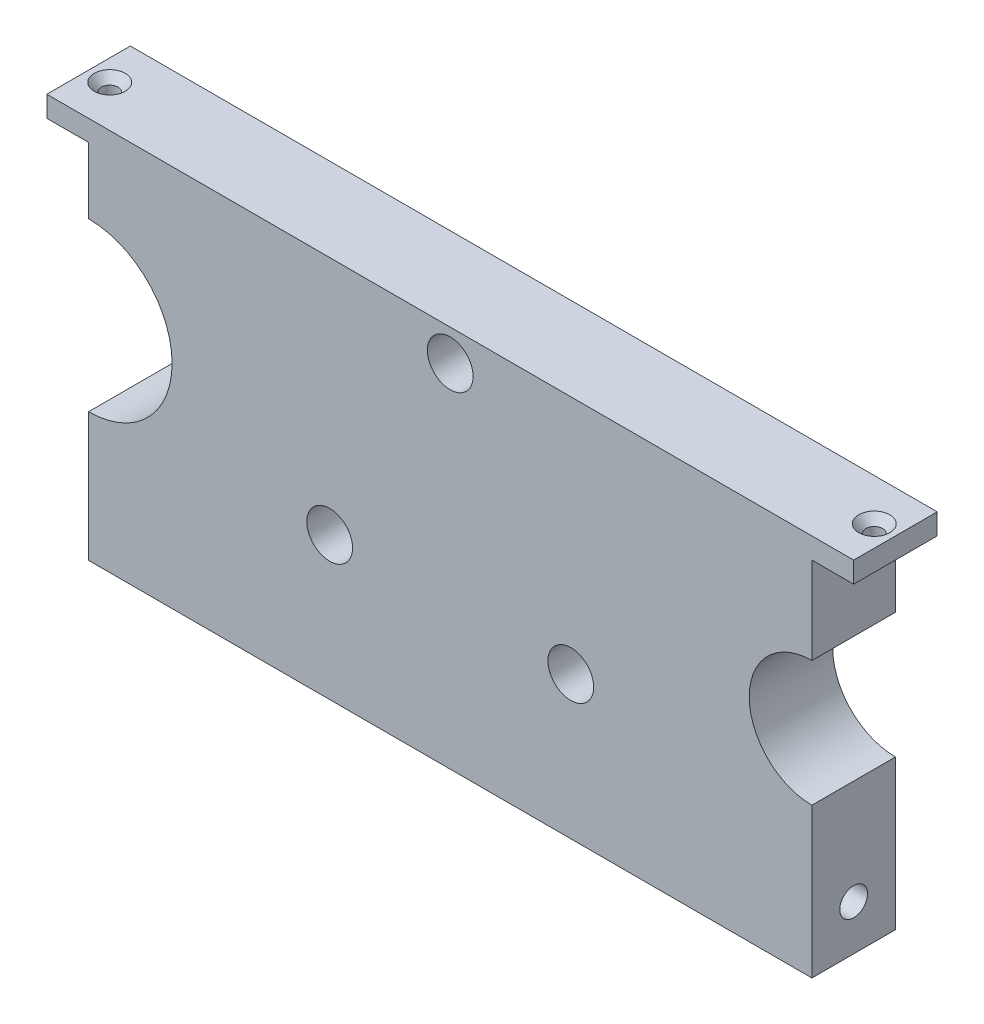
SolidWorks part; units mm, degrees
ref_plane "Front Plane" through (0, 0, 0) normal (0, 0, 1) x (1, 0, 0)
ref_plane "Top Plane" through (0, 0, 0) normal (0, 1, 0) x (1, 0, 0)
ref_plane "Right Plane" through (0, 0, 0) normal (1, 0, 0) x (0, 0, -1)
sketch "Sketch1" plane through (0, 0, 0) normal (1, 0, 0) x (0, 0, -1)
  line L1 (-9.525, -48.4187) -> (9.525, -48.4187)
  line L2 (-9.525, -48.4187) -> (-9.525, 34.1313)
  line L3 (-9.525, 34.1313) -> (9.525, 34.1313)
  line L4 (9.525, -48.4187) -> (9.525, 34.1313)
  line L5 (-9.525, -48.4187) -> (9.525, 34.1313) construction
  line L6 (-9.525, 34.1313) -> (9.525, -48.4187) construction
  dimension "D1" = 19.05
  dimension "D2" = 82.55
  dimension "D3" = 34.1313
extrude "Boss-Extrude1" add sketch "Sketch1" along normal mid plane 164.973
sketch "Sketch9" plane through (0, 0, 0) normal (0, 0, 1) x (1, 0, 0)
  line L0 (82.4865, 34.1313) -> (82.4865, -48.4187) construction
  line L1 (-82.4865, 34.1313) -> (-82.4865, -48.4187) construction
  circle A0 centre (82.4865, 0) radius 14.2875
  circle A1 centre (-82.4865, 0) radius 19.05
  dimension "D1" = 14.2875
  dimension "D2" = 19.05
extrude "Cut-Extrude1" cut sketch "Sketch9" against normal through all and the other way through all
sketch "Sketch8" plane through (0, 0, 0) normal (0, 0, 1) x (1, 0, 0)
  line L0 (-12.7, 38.8938) -> (12.7, 38.8938)
  line L1 (82.4865, 38.8938) -> (12.7, 38.8938)
  line L2 (82.4865, 34.1313) -> (-82.4865, 34.1313)
  line L3 (-82.4865, 38.8938) -> (-12.7, 38.8938)
  line L4 (-82.4865, 34.1313) -> (-92.0115, 34.1313)
  line L5 (-92.0115, 34.1313) -> (-92.0115, 38.8938)
  line L6 (0, 0) -> (0, -20.1707) construction
  line L7 (-92.0115, 38.8938) -> (-82.4865, 38.8938)
  line L8 (92.0115, 38.8938) -> (82.4865, 38.8938)
  line L9 (92.0115, 34.1313) -> (92.0115, 38.8938)
  line L10 (82.4865, 34.1313) -> (92.0115, 34.1313)
  point P2 (0, 38.8938)
  dimension "D1" = 4.7625
  dimension "D2" = 25.4
  dimension "D3" = 184.023
  dimension "D4" = 4.7625
  dimension "D5" = 164.973
extrude "Boss-Extrude2" add sketch "Sketch8" along normal mid plane 19.05
hole_wizard "1/4 (0.25) DiaHole #10 Insert" positions "Sketch3" profile "Sketch2" hole size "1/4" standard "ANSI Inch"
sketch "Sketch3" plane through (-82.4865, 0, 0) normal (-1, 0, 0) x (0, 0, 1)
  line L2 (9.525, 34.1313) -> (-9.525, 34.1313) construction
  point P1 (0, -38.1063)
  dimension "D1" = 72.2376
sketch "Sketch2" plane through (-82.4865, -38.1063, 0) normal (0, 1, 0) x (0, 0, 1)
  line L0 (0, 0) -> (0, 11.4327)
  line L1 (0, 11.4327) -> (3.175, 9.525)
  line L2 (3.175, 9.525) -> (3.175, 0)
  line L5 (3.175, 0) -> (0, 0)
  line L10 (0, 11.4327) -> (-3.175, 9.525) construction
  line L11 (0, -6.35) -> (0, 107.95) construction
  dimension "Hole Dia." = 6.35
  dimension "Hole Depth" = 9.525
  dimension "Drill Angle" = 118
mirror "Mirror1" about plane through (0, 0, 0) normal (1, 0, 0) of "1/4 (0.25) DiaHole #10 Insert"
hole_wizard "CSK for #10 Flat Head Socket Cap Screw3" positions "Sketch7" profile "Sketch6" countersink size "#10" standard "ANSI Inch"
sketch "Sketch7" plane through (0, 0, 9.525) normal (0, 0, 1) x (1, 0, 0)
  line L0 (0, 0) -> (27.4963, -15.875) construction
  line L1 (0, 0) -> (0, 31.75) construction
  line L2 (0, 0) -> (-27.4963, -15.875) construction
  circle A0 centre (0, 0) radius 31.75 construction
  point P0 (0, 31.75)
  point P6 (27.4963, -15.875)
  point P8 (-27.4963, -15.875)
  dimension "D1" = 63.5
  dimension "D2" = 120
  dimension "D3" = 120
sketch "Sketch6" plane through (0, 31.75, 9.525) normal (1, 0, 0) x (0, -1, 0)
  line L0 (0, 0) -> (0, 19.05)
  line L1 (0, 19.05) -> (2.5527, 19.05)
  line L2 (2.5527, 19.05) -> (2.5527, 15.768)
  line L3 (2.5527, 15.768) -> (5.2197, 12.7)
  line L4 (5.2197, 12.7) -> (5.2197, 0)
  line L6 (5.2197, 0) -> (0, 0)
  line L7 (-2.5527, 15.768) -> (-5.2197, 12.7) construction
  line L11 (0, -6.35) -> (0, 107.95) construction
  dimension "Thru Hole Dia." = 5.1054
  dimension "Thru Hole Depth" = 19.05
  dimension "C'Sink Dia." = 10.4394
  dimension "C'Sink Angle" = 82
  dimension "Head Clearance" = 12.7
hole_wizard "CSK for #6 Flat Head Machine Screw1" positions "Sketch13" profile "Sketch12" countersink size "#6" standard "ANSI Inch"
sketch "Sketch13" plane through (0, 38.8938, 0) normal (0, 1, 0) x (1, 0, 0)
  point P0 (-87.1855, 0)
  point P1 (87.1855, 0)
  dimension "D1" = 87.1855
  dimension "D2" = 87.1855
sketch "Sketch12" plane through (-87.1855, 38.8938, 0) normal (1, 0, 0) x (0, 0, 1)
  line L0 (0, 0) -> (0, 87.3125)
  line L1 (0, 87.3125) -> (1.8986, 87.3125)
  line L2 (1.8986, 87.3125) -> (1.8986, 1.892)
  line L3 (1.8986, 1.892) -> (3.5433, 0)
  line L5 (3.5433, 0) -> (0, 0)
  line L6 (-1.8986, 1.892) -> (-3.5433, 0) construction
  line L11 (0, -6.35) -> (0, 107.95) construction
  dimension "Thru Hole Dia." = 3.7973
  dimension "Thru Hole Depth" = 87.3125
  dimension "Near C'Sink Dia." = 7.0866
  dimension "Near C'Sink Angle" = 82
sketch "Sketch10" plane through (0, 0, 0) normal (0, 0, 1) x (1, 0, 0)
  line L0 (-22.225, 44.45) -> (-22.225, 69.9129)
  line L5 (22.225, 44.45) -> (22.225, 69.9129)
  line L6 (-22.225, 69.9129) -> (22.225, 69.9129)
  arc A0 (-22.225, 44.45) -> (22.225, 44.45) centre (0, 44.45) ccw
  dimension "D1" = 44.45
  dimension "D2" = 44.45
extrude "Cut-Extrude2" [suppressed] cut sketch "Sketch10" against normal through all and the other way through all
chamfer "Chamfer1" [suppressed] distance 9.525 angle 45
equation "\"Buoyancy\"=\"SW-Volume\"*(\"SW-Density\"-.037062)"
